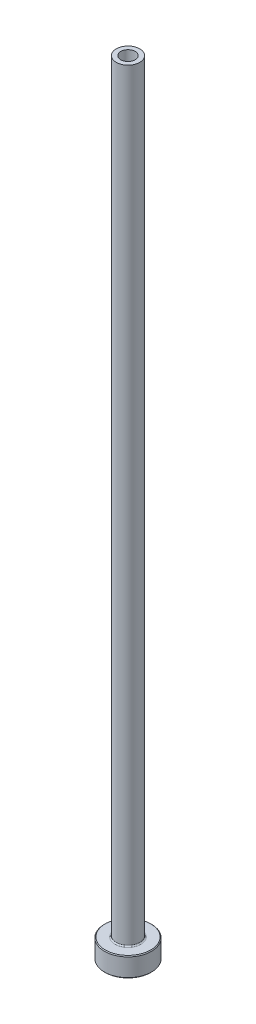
SolidWorks part; units mm, degrees
ref_plane "Front Plane" through (0, 0, 0) normal (0, 0, 1) x (1, 0, 0)
ref_plane "Top Plane" through (0, 0, 0) normal (0, 1, 0) x (1, 0, 0)
ref_plane "Right Plane" through (0, 0, 0) normal (1, 0, 0) x (0, 0, -1)
sketch "Sketch1" plane through (0, 0, 0) normal (0, 0, 1) x (1, 0, 0)
  line L0 (-1.85, 200) -> (-3, 200)
  line L1 (-3, 200) -> (-3, 5)
  line L2 (-3, 5) -> (-6, 5)
  line L3 (-6, 5) -> (-6, 0)
  line L4 (6.6, 0) -> (-6.6, 0) construction
  line L5 (-6, 0) -> (-2.1, 0)
  line L6 (-1.85, 155) -> (-1.85, 200)
  line L7 (0, 92.1877) -> (0, -15.5353) construction
  line L8 (0, -6.6) -> (0, 6.6) construction
  line L9 (-1.85, 155) -> (-2.1, 143)
  line L10 (-2.1, 143) -> (-2.1, 0)
  dimension "D1" = 0.25
  dimension "ID" = 3.7
  dimension "OD" = 6
  dimension "L" = 200
  dimension "H" = 12
  dimension "T" = 5
  dimension "N" = 45
  dimension "D2" = 12
revolve "Revolve1" add sketch "Sketch1" angle 360 about L7
fillet "Fillet1" radius 0.3 1 edges at (0, 5, 3)
chamfer "Chamfer1" distance 0.2 angle 45 2 edges at (0, 5, 6) (0, 0, 6)
chamfer "Chamfer3" distance 0.5 angle 45 1 edges at (0, 0, 2.1)
